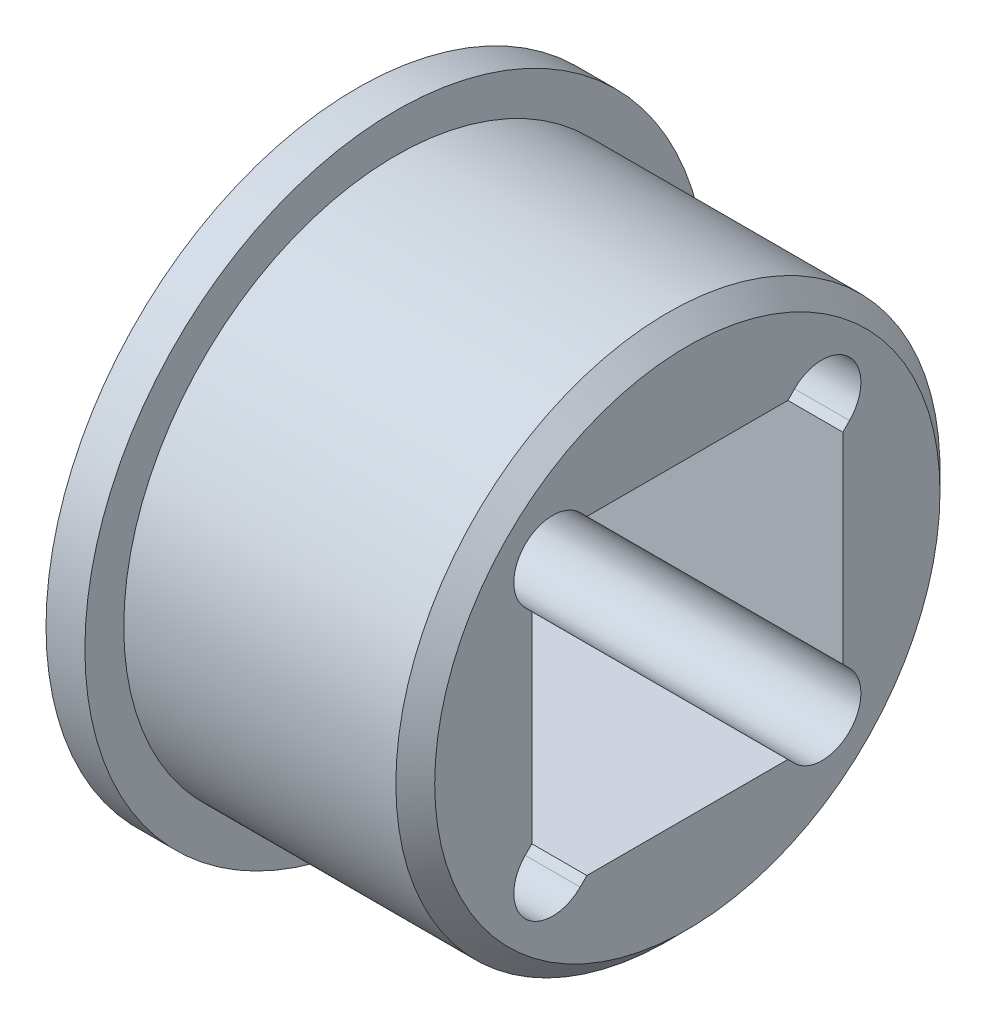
SolidWorks part; units mm, degrees
ref_plane "Plan de face" through (0, 0, 0) normal (0, 0, 1) x (1, 0, 0)
ref_plane "Plan de dessus" through (0, 0, 0) normal (0, 1, 0) x (1, 0, 0)
ref_plane "Plan de droite" through (0, 0, 0) normal (1, 0, 0) x (0, 0, -1)
sketch "Esquisse1" plane through (0, 0, 0) normal (0, 0, 1) x (1, 0, 0)
  line L0 (-19.0972, 0) -> (8.7608, 0) construction
  line L2 (0, 0) -> (17, 0)
  line L3 (0, 0) -> (0, 16)
  line L4 (0, 16) -> (2, 16)
  line L5 (17, 0) -> (17, 14)
  line L8 (17, 14) -> (2, 14)
  line L9 (2, 16) -> (2, 14)
  dimension "D1" = 2
  dimension "D2" = 15
  dimension "D3" = 16
  dimension "D4" = 14
revolve "Révolution1" add sketch "Esquisse1" angle 360 about L0
sketch "Esquisse2" plane through (17, 0, 0) normal (1, 0, 0) x (0, 0, -1)
  line L0 (-12.0208, 12.0208) -> (0, 0) construction
  line L1 (-8, 8) -> (8, 8)
  line L2 (-8, 8) -> (-8, -8)
  line L3 (-8, -8) -> (8, -8)
  line L4 (8, 8) -> (8, -8)
  line L5 (0, 0) -> (-30.1216, 0) construction
  dimension "D1" = 16
  dimension "D2" = 16
  dimension "D3" = 8
  dimension "D4" = 8
  dimension "D5" = 17
  dimension "D7" = 45
extrude "Enlèv. mat.-Extru.1" cut sketch "Esquisse2" against normal through all
chamfer "Chanfrein1" distance 1 angle 45 1 edges at (17, 0, 14)
sketch "Esquisse3" plane through (17, 0, 0) normal (1, 0, 0) x (0, 0, -1)
  line L0 (0, 0) -> (6.9296, 6.9296) construction
  line L1 (8.3439, 5.5154) -> (4.6326, 9.2267) construction
  line L2 (5.5154, 8.3439) -> (5.1716, 8)
  line L3 (8, 8) -> (-8, 8) construction
  line L4 (8.3439, 5.5154) -> (8, 5.1716)
  line L5 (8, -8) -> (8, 8) construction
  line L6 (5.1716, 8) -> (8, 5.1716)
  line L7 (8.3439, -5.5154) -> (8, -5.1716)
  line L8 (5.5154, -8.3439) -> (5.1716, -8)
  line L9 (8, -5.1716) -> (5.1716, -8)
  line L10 (5.5154, -8.3439) -> (9.2267, -4.6326) construction
  line L11 (-5.5154, -8.3439) -> (-5.1716, -8)
  line L12 (-8.3439, -5.5154) -> (-8, -5.1716)
  line L13 (-5.1716, -8) -> (-8, -5.1716)
  line L14 (-8.3439, -5.5154) -> (-4.6326, -9.2267) construction
  line L15 (-8.3439, 5.5154) -> (-8, 5.1716)
  line L16 (-5.5154, 8.3439) -> (-5.1716, 8)
  line L17 (-8, 5.1716) -> (-5.1716, 8)
  line L18 (-5.5154, 8.3439) -> (-9.2267, 4.6326) construction
  arc A0 (8.3439, 5.5154) -> (5.5154, 8.3439) centre (6.9296, 6.9296) ccw
  arc A1 (5.5154, -8.3439) -> (8.3439, -5.5154) centre (6.9296, -6.9296) ccw
  arc A2 (-8.3439, -5.5154) -> (-5.5154, -8.3439) centre (-6.9296, -6.9296) ccw
  arc A3 (-5.5154, 8.3439) -> (-8.3439, 5.5154) centre (-6.9296, 6.9296) ccw
  dimension "D2" = 4
  dimension "D1" = 9.8
  dimension "D3" = 4
extrude "Enlèv. mat.-Extru.2" cut sketch "Esquisse3" against normal through all
